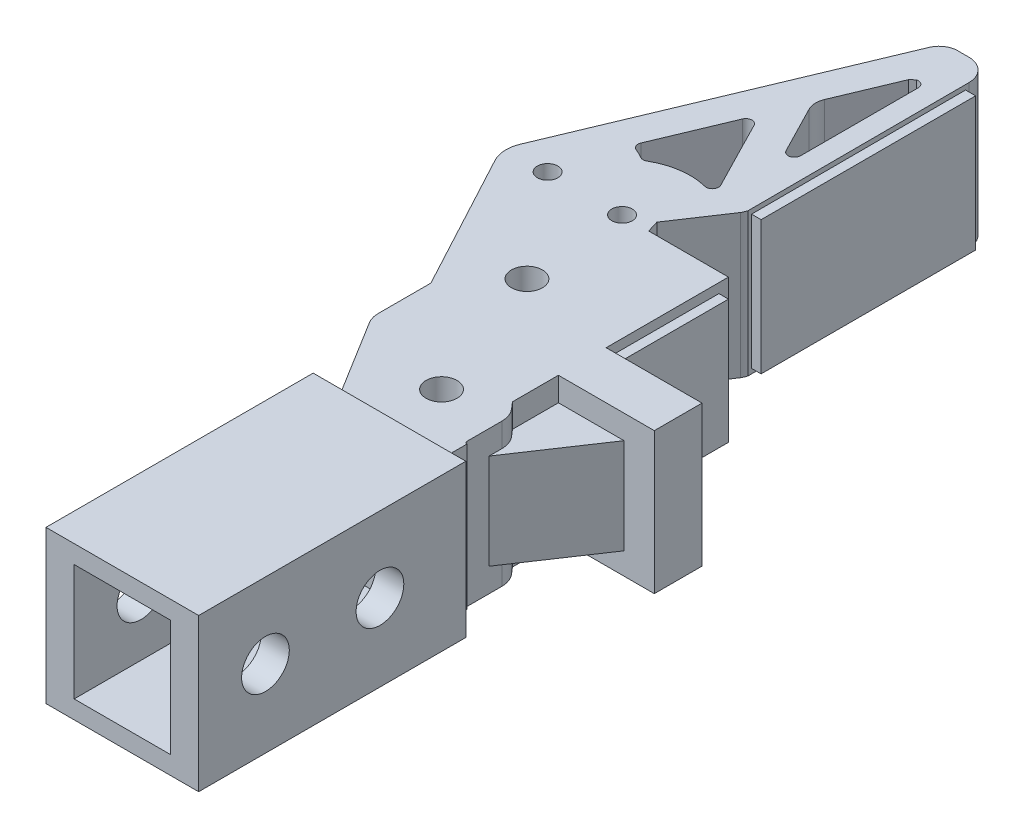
SolidWorks part; units mm, degrees
ref_plane "Alzado" through (0, 0, 0) normal (0, 0, 1) x (1, 0, 0)
ref_plane "Planta" through (0, 0, 0) normal (0, 1, 0) x (1, 0, 0)
ref_plane "Vista lateral" through (0, 0, 0) normal (1, 0, 0) x (0, 0, -1)
sketch "Croquis1" plane through (0, 0, 0) normal (0, 1, 0) x (1, 0, 0)
  line L0 (18.6195, -63.7365) -> (15.4788, -71.2468)
  line L1 (23.4981, -70.8922) -> (19.7973, -63.6902)
  line L2 (21.2126, -59.3337) -> (23.7797, -64.3294)
  line L3 (23.7582, -51.4483) -> (21.148, -57.6901)
  line L4 (25.0079, -64.0323) -> (25.0079, -51.699)
  line L9 (9.2725, -77.6641) -> (10.2186, -75.4015)
  line L10 (10.6346, -74.4068) -> (10.2186, -75.4015)
  line L11 (10.6346, -74.4068) -> (21.907, -47.451)
  line L13 (23.7058, -46.262) -> (24.8929, -46.2648)
  line L14 (27.544, -96.0434) -> (32.8286, -102.1422)
  line L15 (33.4392, -103.7794) -> (33.4392, -107.4469)
  line L16 (22.5204, -109.7992) -> (17.5627, -101.778)
  line L17 (17.1892, -89.4522) -> (17.1892, -100.4636)
  line L18 (23.7582, -51.4483) -> (24.195, -51.0698)
  line L19 (26.9334, -90.9455) -> (26.9334, -94.4063)
  line L20 (17.1892, -94.9579) -> (9.4071, -80.4546)
  line L21 (26.9334, -90.9455) -> (23.879, -78.8216)
  line L24 (22.5204, -109.7992) -> (33.6892, -109.7992)
  line L25 (33.6892, -107.6969) -> (33.6892, -109.7992)
  line L30 (23.879, -78.8216) -> (23.4981, -77.5902)
  line L31 (25.0353, -77.0872) -> (22.7227, -80.5561) construction
  line L32 (24.2033, -76.5325) -> (21.8906, -80.0014) construction
  line L35 (27.1871, -48.5593) -> (27.2389, -71.7765)
  line L36 (26.9975, -72.3412) -> (25.0143, -75.316)
  line L37 (24.2033, -76.5325) -> (25.0143, -75.316)
  line L38 (24.2033, -76.5325) -> (23.4981, -77.5902)
  line L39 (18.0704, -94.4851) -> (10.2882, -79.9818) construction
  line L40 (10.1951, -78.0499) -> (11.1412, -75.7873) construction
  line L41 (11.5572, -74.7926) -> (11.1412, -75.7873) construction
  line L42 (11.5572, -74.7926) -> (22.8287, -47.8391) construction
  line L43 (23.7035, -47.262) -> (25.2842, -47.2658) construction
  line L44 (25.0353, -77.0872) -> (25.8463, -75.8707) construction
  line L45 (27.8414, -72.8781) -> (25.8463, -75.8707) construction
  line L46 (28.1876, -48.7788) -> (28.2392, -71.8971) construction
  arc A0 (23.2652, -71.7401) -> (23.4981, -70.8922) centre (22.92, -71.1893) ccw
  arc A1 (22.7613, -71.8197) -> (22.8172, -71.8312) centre (22.92, -71.1893) ccw
  arc A2 (22.8172, -71.8312) -> (23.2652, -71.7401) centre (22.92, -71.1893) ccw
  arc A3 (22.7613, -71.8197) -> (17.441, -72.5613) centre (21.016, -78.7534) ccw
  arc A4 (17.116, -72.6484) -> (17.441, -72.5613) centre (17.116, -71.9984) ccw
  arc A5 (16.791, -72.5613) -> (17.116, -72.6484) centre (17.116, -71.9984) ccw
  arc A6 (16.791, -72.5613) -> (15.8399, -72.1022) centre (13.216, -78.7534) ccw
  arc A7 (15.4943, -71.7826) -> (15.8399, -72.1022) centre (16.0785, -71.4976) ccw
  arc A8 (15.4788, -71.2468) -> (15.4943, -71.7826) centre (16.0785, -71.4976) ccw
  arc A9 (19.7973, -63.6902) -> (19.0563, -63.358) centre (19.2191, -63.9873) ccw
  arc A10 (19.0563, -63.358) -> (18.6195, -63.7365) centre (19.2191, -63.9873) ccw
  arc A11 (24.7509, -64.5501) -> (25.0079, -64.0323) centre (24.3579, -64.0323) ccw
  arc A12 (23.7797, -64.3294) -> (24.7509, -64.5501) centre (24.3579, -64.0323) ccw
  arc A13 (21.0967, -59.058) -> (21.2126, -59.3337) centre (22.947, -58.4424) ccw
  arc A14 (21.148, -57.6901) -> (21.0967, -59.058) centre (22.947, -58.4424) ccw
  arc A15 (25.0079, -51.699) -> (24.7509, -51.1813) centre (24.3579, -51.699) ccw
  arc A16 (24.7509, -51.1813) -> (24.195, -51.0698) centre (24.3579, -51.699) ccw
  arc A20 (9.2725, -77.6641) -> (9.4071, -80.4546) centre (12.2709, -78.918) ccw
  arc A21 (23.7058, -46.262) -> (21.907, -47.451) centre (23.7012, -48.2102) ccw
  circle A23 centre (21.016, -78.7534) radius 1.0725
  circle A24 centre (13.216, -78.7534) radius 1.0725
  arc A25 (26.9334, -94.4063) -> (27.544, -96.0434) centre (29.4334, -94.4063) ccw
  arc A26 (33.4392, -103.7794) -> (32.8286, -102.1422) centre (30.9392, -103.7794) ccw
  arc A27 (33.4392, -107.4469) -> (33.6892, -107.6969) centre (33.6892, -107.4469) ccw
  arc A28 (17.1892, -100.4636) -> (17.5627, -101.778) centre (19.6892, -100.4636) ccw
  circle A33 centre (27.3927, -104.0488) radius 1.625
  circle A34 centre (21.8402, -89.5423) radius 1.625
  arc A48 (24.8929, -46.2648) -> (27.1871, -48.5593) centre (24.8875, -48.5644) cw
  arc A51 (26.9975, -72.3412) -> (27.2389, -71.7765) centre (25.0687, -71.1826) ccw
  arc A54 (10.1951, -78.0499) -> (10.2882, -79.9818) centre (12.2709, -78.918) ccw construction
  arc A55 (23.7035, -47.262) -> (22.8287, -47.8391) centre (23.7012, -48.2102) ccw construction
  arc A56 (27.1871, -48.5593) -> (25.2842, -47.2658) centre (26.1828, -47.9903) ccw construction
  arc A58 (27.8414, -72.8781) -> (28.2392, -71.8971) centre (25.0687, -71.1826) ccw construction
  arc A76 (28.1876, -48.7788) -> (24.8929, -46.2648) centre (26.1828, -47.9903) ccw construction
  dimension "D2" = 0.25
  dimension "D1" = 1
extrude "Saliente-Extruir1" add sketch "Croquis1" along normal mid plane 15
sketch "Sketch2" plane through (0, 7.5, 0) normal (0, 1, 0) x (1, 0, 0)
sketch "Sketch4" plane through (0, 7.5, 0) normal (0, 1, 0) x (1, 0, 0)
  line L0 (23.879, -78.8216) -> (32.2394, -78.8216)
  line L1 (32.2394, -78.8216) -> (32.2394, -101.4623)
  line L2 (27.544, -96.0434) -> (32.8286, -102.1422) construction
  line L3 (17.7401, -35.423) -> (25.2834, -40.7304)
  line L4 (25.2834, -40.7304) -> (17.7401, -59.6041)
  line L5 (17.7401, -59.6041) -> (17.7401, -35.423)
  line L7 (26.9334, -90.9455) -> (26.9334, -94.4063) construction
  line L9 (27.544, -96.0434) -> (32.2394, -101.4623)
  line L10 (26.9334, -90.9455) -> (26.9334, -94.4063)
  line L15 (26.9334, -90.9455) -> (23.879, -78.8216) construction
  line L16 (26.9334, -90.9455) -> (23.879, -78.8216)
  line L17 (32.9334, -90.2014) -> (29.6972, -77.3559) construction
  line L19 (32.9334, -93.1008) -> (36.774, -97.5331) construction
  line L20 (32.9334, -90.2014) -> (32.9334, -93.1008) construction
  arc A1 (26.9334, -94.4063) -> (27.544, -96.0434) centre (29.4334, -94.4063) ccw construction
  arc A3 (26.9334, -94.4063) -> (27.544, -96.0434) centre (29.4334, -94.4063) ccw
  arc A5 (26.3567, -56.7968) -> (26.4685, -56.8198) centre (26.6741, -55.5361) ccw
  arc A6 (32.9334, -93.1008) -> (32.9334, -93.1008) centre (32.9334, -93.1008) ccw
  dimension "D1" = 6
  dimension "D2" = 8.3604
extrude "Boss-Extrude1" add sketch "Sketch4" against normal through all
sketch "Sketch7" plane through (0, 0, 109.7992) normal (0, 0, 1) x (1, 0, 0)
  line L0 (22.5204, 7.5) -> (22.5204, -7.5) construction
  line L1 (19.6904, 8) -> (19.6904, -8)
  line L2 (19.6904, -8) -> (35.6904, -8)
  line L4 (35.6904, 8) -> (35.6904, -8)
  line L5 (28.1048, 7.5) -> (28.1048, -26.4269) construction
  line L6 (22.5204, 7.5) -> (33.6892, 7.5) construction
  line L12 (19.6904, 8) -> (35.6904, 8)
  point P6 (28.1048, 0)
  dimension "D2" = 8
  dimension "D3" = 16
  dimension "D1" = 16
  dimension "D4" = 2.83
extrude "Boss-Extrude2" add sketch "Sketch7" along normal blind 28 contours L4 L2 L1 L12
sketch "Sketch8" plane through (19.6904, 0, 0) normal (-1, 0, 0) x (0, 0, 1)
  circle A2 centre (130.7992, 0.1) radius 2.5 construction
  circle A3 centre (118.7992, 0.1) radius 2.5 construction
  circle A4 centre (130.7992, 0.1) radius 2.5
  circle A5 centre (118.7992, 0.1) radius 2.5
sketch "Sketch9" plane through (0, 0, 137.7992) normal (0, 0, 1) x (1, 0, 0)
  line L0 (32.7404, 0) -> (30.5993, 0) construction
  line L2 (22.6404, -6.1) -> (32.7404, -6.1)
  line L9 (22.6404, -6.1) -> (22.6404, 6.1)
  line L10 (22.6404, 6.1) -> (32.7404, 6.1)
  line L14 (32.7404, -6.1) -> (32.7404, 6.1)
  line L15 (22.6404, -6.1) -> (32.7404, 6.1) construction
  line L16 (22.6404, 6.1) -> (32.7404, -6.1) construction
  line L17 (35.6904, 0) -> (35.0984, 0) construction
  line L18 (35.6904, 8) -> (35.6904, -8) construction
  line L19 (27.6904, -8) -> (27.6904, -6.7157) construction
  line L20 (19.6904, -8) -> (35.6904, -8) construction
  line L21 (27.6904, -6.1) -> (27.6904, -2.9602) construction
  point P0 (27.6904, 0)
  dimension "D1" = 10.1
  dimension "D2" = 12.2
ref_plane "Plane1" through (25.6904, 0, 0) normal (-1, 0, 0) x (0, 0, 1)
sketch "Sketch10" plane through (25.6904, 0, 0) normal (-1, 0, 0) x (0, 0, 1)
  line L0 (113.9471, 8) -> (109.7992, 7.5)
  line L1 (137.7992, 8) -> (109.7992, 8) construction
  line L2 (109.7992, 7.5) -> (109.7992, 8)
  line L3 (109.7992, 8) -> (113.9471, 8)
  line L4 (137.7992, 0) -> (128.384, 0) construction
  line L5 (137.7992, 8) -> (137.7992, -8) construction
  line L6 (113.9471, -8) -> (109.7992, -7.5)
  line L7 (109.7992, -8) -> (113.9471, -8)
  line L8 (109.7992, -7.5) -> (109.7992, -8)
extrude "Boss-Extrude3" add sketch "Sketch10" along normal mid plane 8 contours L3 L0 L2 | L6 L8 L7
extrude "Cut-Extrude6" cut sketch "Sketch8" against normal blind 30
ref_plane "Plane2" through (0, -7, 0) normal (0, -1, 0) x (-1, 0, 0)
sketch "Sketch11" plane through (0, -7, 0) normal (0, -1, 0) x (-1, 0, 0)
  line L0 (-27.1871, -48.5593) -> (-27.2389, -71.7765) construction
  line L1 (-27.1879, -48.9189) -> (-27.2381, -71.4007)
  line L3 (-27.1879, -48.9189) -> (-28.2381, -48.9189)
  line L5 (-27.2381, -71.4007) -> (-28.2381, -71.4007)
  line L6 (-28.2381, -48.9189) -> (-28.2381, -71.4007)
  dimension "D1" = 1
extrude "Boss-Extrude4" add sketch "Sketch11" against normal blind 14
sketch "Sketch12" plane through (32.2394, 0, 0) normal (1, 0, 0) x (0, 0, -1)
  line L0 (-94.9579, -7.3) -> (-100.4636, -7.3) construction
  line L5 (-78.8216, 7.5) -> (-101.4623, 7.5) construction
  line L6 (-101.6441, -7.5) -> (-101.6441, 7.5) construction
  line L17 (-96.6441, -7.3) -> (-91.6441, -7.3)
  line L18 (-91.6441, -7.3) -> (-91.6441, 7.5)
  line L19 (-91.6441, 7.5) -> (-96.6441, 7.5)
  line L20 (-96.6441, 7.5) -> (-96.6441, -7.3)
  dimension "D1" = 5
  dimension "D2" = 5
extrude "Boss-Extrude5" add sketch "Sketch12" along normal blind 10.05
sketch "Sketch13" plane through (32.2394, 0, 0) normal (1, 0, 0) x (0, 0, -1)
  line L1 (-90.6441, 6.5) -> (-79.8216, 6.5)
  line L2 (-90.6441, 6.5) -> (-90.6441, -6.5)
  line L3 (-90.6441, -6.5) -> (-79.8216, -6.5)
  line L4 (-79.8216, 6.5) -> (-79.8216, -6.5)
  line L7 (-91.6441, -7.3) -> (-91.6441, 7.5) construction
  line L8 (-78.8216, -7.5) -> (-78.8216, 7.5) construction
  line L9 (-78.8216, -7.5) -> (-101.4623, -7.5) construction
  line L10 (-78.8216, 7.5) -> (-91.6441, 7.5) construction
  dimension "D1" = 1
  dimension "D2" = 1
  dimension "D3" = 1
  dimension "D4" = 1
extrude "Boss-Extrude6" add sketch "Sketch13" along normal blind 1
sketch "Sketch14" plane through (0, 0, 0) normal (0, 1, 0) x (1, 0, 0)
  line L0 (19.6904, -109.7992) -> (20.2925, -106.1946)
  line L1 (22.5204, -109.7992) -> (17.5627, -101.778) construction
  line L2 (20.2925, -106.1946) -> (22.5204, -109.7992)
  line L3 (22.5204, -109.7992) -> (19.6904, -109.7992)
extrude "Boss-Extrude7" add sketch "Sketch14" along normal mid plane 10
extrude "Cut-Extrude7" cut sketch "Sketch9" against normal blind 25.5
sketch "Sketch15" plane through (0, 0, 0) normal (0, 1, 0) x (1, 0, 0)
  line L0 (33.4392, -105.1121) -> (39.1106, -96.6441)
  line L1 (33.4392, -103.7794) -> (33.4392, -107.4469) construction
  line L2 (42.2894, -96.6441) -> (32.2394, -96.6441) construction
  line L3 (39.1106, -96.6441) -> (32.2394, -96.6441)
  line L4 (32.2394, -101.4623) -> (32.8286, -102.1422) construction
  line L5 (32.2394, -96.6441) -> (32.2394, -101.4623) construction
  line L6 (33.4392, -103.7794) -> (33.4392, -105.1121)
  line L7 (32.2394, -101.4623) -> (32.8286, -102.1422)
  line L8 (32.2394, -96.6441) -> (32.2394, -101.4623)
  arc A0 (33.4392, -103.7794) -> (32.8286, -102.1422) centre (30.9392, -103.7794) ccw construction
  arc A1 (33.4392, -103.7794) -> (32.8286, -102.1422) centre (30.9392, -103.7794) ccw
extrude "Boss-Extrude8" add sketch "Sketch15" along normal mid plane 10
